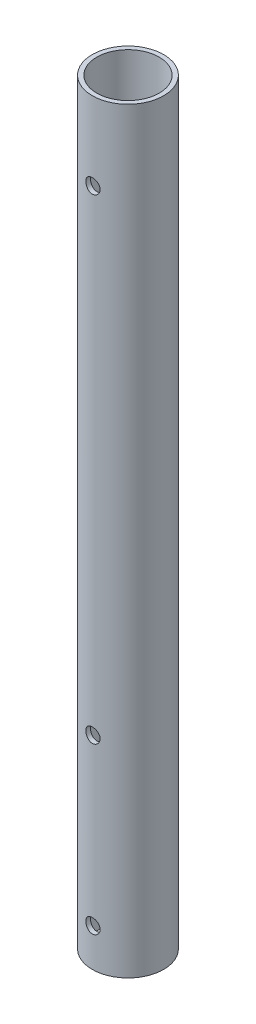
SolidWorks part; units mm, degrees
ref_plane "前视基准面" through (0, 0, 0) normal (0, 0, 1) x (1, 0, 0)
ref_plane "上视基准面" through (0, 0, 0) normal (0, 1, 0) x (1, 0, 0)
ref_plane "右视基准面" through (0, 0, 0) normal (1, 0, 0) x (0, 0, -1)
other "Configuration Table"
sketch "草图1" plane through (0, 0, 0) normal (0, 1, 0) x (1, 0, 0)
  circle A0 centre (0, 0) radius 8
  circle A1 centre (0, 0) radius 7
  dimension "D1" = 14
  dimension "D2" = 16
extrude "凸台-拉伸1" add sketch "草图1" along normal blind 169.65
sketch "草图3" plane through (0, 0, 0) normal (0, 0, 1) x (1, 0, 0)
  circle A0 centre (0, 152.15) radius 1.6
  circle A1 centre (0, 45.5) radius 1.6
  circle A2 centre (0, 8.5) radius 1.6
  dimension "D1" = 3.2
  dimension "D2" = 3.2
  dimension "D3" = 3.2
extrude "切除-拉伸1" cut sketch "草图3" against normal through all both and the other way through all
